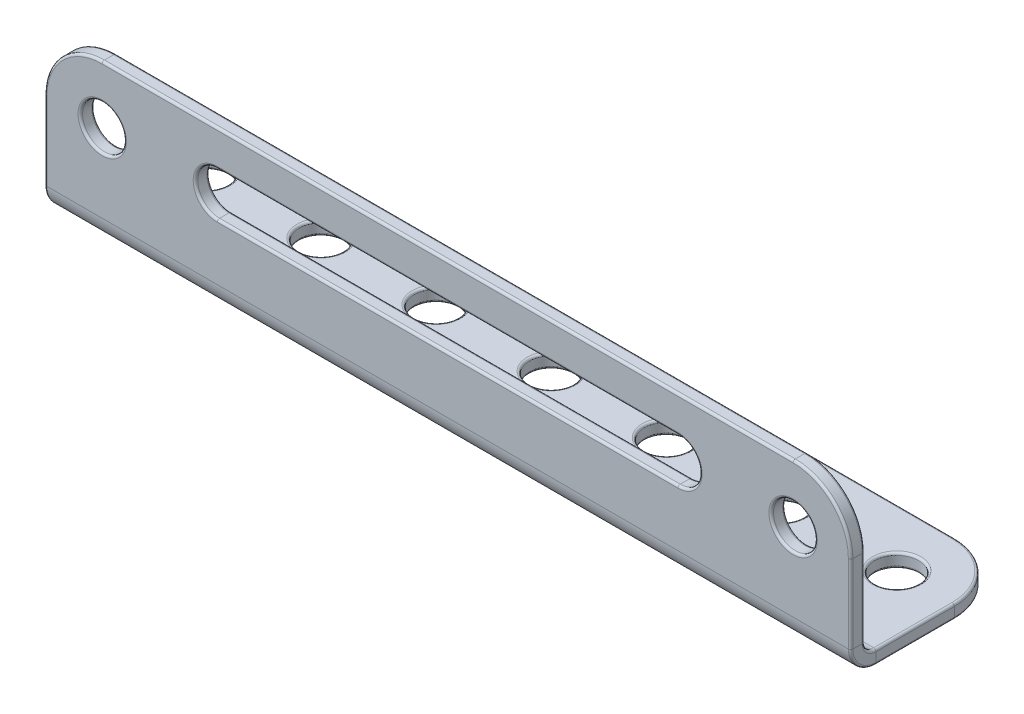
SolidWorks part; units mm, degrees
ref_plane "Front" through (0, 0, 0) normal (0, 0, 1) x (1, 0, 0)
ref_plane "Top" through (0, 0, 0) normal (0, 1, 0) x (1, 0, 0)
ref_plane "Right" through (0, 0, 0) normal (1, 0, 0) x (0, 0, -1)
sketch "Sketch1" plane through (0, 0, 0) normal (0, 1, 0) x (1, 0, 0)
  line L1 (6.35, 0) -> (82.55, 0)
  line L2 (0, 6.35) -> (0, 29.21)
  line L3 (6.35, 35.56) -> (82.55, 35.56)
  line L4 (88.9, 6.35) -> (88.9, 29.21)
  line L5 (19.05, 8.763) -> (69.85, 8.763)
  line L7 (19.05, 3.937) -> (69.85, 3.937)
  circle A0 centre (6.35, 6.35) radius 2.413
  circle A2 centre (82.55, 6.35) radius 2.413
  arc A3 (6.35, 0) -> (0, 6.35) centre (6.35, 6.35) cw
  arc A4 (0, 29.21) -> (6.35, 35.56) centre (6.35, 29.21) cw
  arc A5 (82.55, 35.56) -> (88.9, 29.21) centre (82.55, 29.21) cw
  arc A6 (82.55, 0) -> (88.9, 6.35) centre (82.55, 6.35) ccw
  arc A7 (19.05, 8.763) -> (19.05, 3.937) centre (19.05, 6.35) ccw
  arc A8 (69.85, 3.937) -> (69.85, 8.763) centre (69.85, 6.35) ccw
  point P20 (0, 0)
  point P23 (0, 35.56)
  point P26 (88.9, 35.56)
  dimension "D3" = 12.7
  dimension "D5" = 6.35
  dimension "D4" = 4.826
  dimension "D1" = 35.56
  dimension "D2" = 88.9
  dimension "D7" = 50.8
sheet metal parameters "Sheet-Metal1" thickness 1.524 parameters "D1"=3.81
base flange "Base-Flange1" sketch "Sketch1" thickness 1.524 reverse thickness direction yes parameters "D1"=3.81
sketch "Sketch3" plane through (0, 1.524, 0) normal (0, 1, 0) x (-1, 0, 0)
  line L1 (0, -29.21) -> (0, -6.35) construction
  line L2 (-88.9, -6.35) -> (-88.9, -29.21) construction
  line L4 (-6.35, 0) -> (-82.55, 0) construction
  line L6 (0, -17.78) -> (-88.9, -17.78)
  dimension "D1" = 17.78
sketched bend "Sketched Bend1" parameters "D1"=1.27
bend "SketchBend2" bend radius 1.27 bend angle 90 parameters "D5"=1
sketch "Sketch4" plane through (0, 1.524, 0) normal (0, 1, 0) x (-1, 0, 0)
  circle A0 centre (-6.35, -29.21) radius 2.413
  arc A2 (-6.35, -35.56) -> (0, -29.21) centre (-6.35, -29.21) ccw construction
  dimension "D1" = 4.826
extrude "Cut-Extrude1" cut sketch "Sketch4" against normal through all
pattern_linear "LPattern1" count 7 spacing 12.7 along (1, 0, 0) of "Cut-Extrude1"
fillet "Fillet1" radius 0.254 50 edges at (87.0401, 15.9201, -19.304) (31.75, 0, -26.797) (31.75, 1.524, -26.797) (44.45, 0, -26.797) (44.45, 1.524, -26.797) (57.15, 0, -26.797) (57.15, 1.524, -26.797) (69.85, 0, -26.797) (69.85, 1.524, -26.797) (82.55, 0, -26.797) (82.55, 1.524, -26.797) (88.9, 7.112, -19.304) (16.637, 11.43, -17.78) (44.45, 13.843, -17.78) (72.263, 11.43, -17.78) (44.45, 9.017, -17.78) (16.637, 11.43, -19.304) (44.45, 13.843, -19.304) (72.263, 11.43, -19.304) (44.45, 9.017, -19.304) (6.35, 13.843, -17.78) (6.35, 13.843, -19.304) (82.55, 13.843, -17.78) (82.55, 13.843, -19.304) (1.8599, 15.9201, -19.304) (0, 7.112, -17.78) (0, 7.112, -19.304) (44.45, 17.78, -19.304) (1.8599, 0, -33.7001) (44.45, 0, -35.56) (87.0401, 0, -33.7001) (0, 1.524, -24.892) (88.9, 1.524, -24.892) (87.0401, 1.524, -33.7001) (44.45, 1.524, -35.56) (1.8599, 1.524, -33.7001) (88.9, 0, -24.892) (0, 0, -24.892) (0, 0.8183, -18.5983) (88.9, 0.8183, -18.5983) (88.9, 1.896, -19.676) (0, 1.896, -19.676) (88.9, 7.112, -17.78) (87.0401, 15.9201, -17.78) (6.35, 0, -26.797) (6.35, 1.524, -26.797) (44.45, 17.78, -17.78) (19.05, 0, -26.797) (19.05, 1.524, -26.797) (1.8599, 15.9201, -17.78)
flat pattern "Flat-Pattern1"
sketch "Bend-Lines1" plane through (0, 0, 0) normal (0, 1, 0) x (-1, 0, 0)
bend of the flat pattern "Flatten-<SketchBend2>1"
